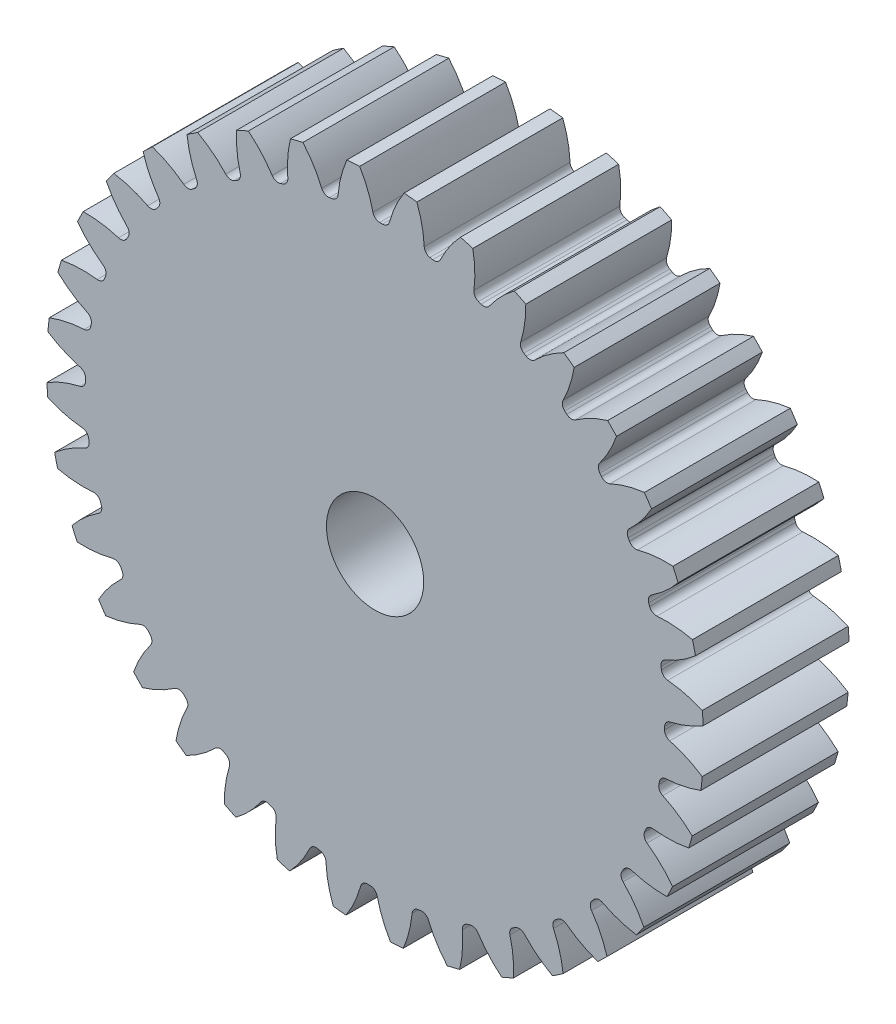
SolidWorks part; units mm, degrees
ref_plane "Front" through (0, 0, 0) normal (0, 0, 1) x (1, 0, 0)
ref_plane "Top" through (0, 0, 0) normal (0, 1, 0) x (1, 0, 0)
ref_plane "Right" through (0, 0, 0) normal (1, 0, 0) x (0, 0, -1)
sketch "Sketch3" plane through (0, 0, 0) normal (0, 0, 1) x (1, 0, 0)
  circle A0 centre (0, 0) radius 214.4889
  dimension "od" = 428.9778
extrude "gearBody" add sketch "Sketch3" along normal blind 95.25
sketch "Sketch2" plane through (0, 0, 0) normal (0, 0, 1) x (1, 0, 0)
  line L0 (0, 0) -> (176.4107, 73.0717) construction
  line L1 (213.8789, -19.1165) -> (0, 0) construction
  line L2 (0, 0) -> (36.3143, 0) construction
  line L3 (203.1478, 4.6072) -> (202.7804, -13.0525) construction
  line L5 (202.9641, -4.2227) -> (0, 0) construction
  line L7 (0, 0) -> (190.9455, 0) construction
  arc A0 (190.9428, 1.0226) -> (190.735, -8.9634) centre (0, 0) ccw construction
  arc A1 (214.2528, 10.0619) -> (213.6489, -18.9644) centre (0, 0) ccw construction
  arc A2 (203.1478, 4.6072) -> (202.7804, -13.0525) centre (0, 0) ccw construction
  arc A3 (189.0268, -4.8452) -> (189.0648, -3.021) centre (0, 0) ccw
  arc A4 (213.8789, -19.1165) -> (192.4196, -9.3979) centre (173.2188, -80.3457) ccw
  arc A5 (213.8789, -19.1165) -> (214.4889, 10.2043) centre (0, 0) ccw
  arc A6 (214.4889, 10.2043) -> (192.644, 1.3867) centre (176.4107, 73.0717) cw
  arc A7 (189.0648, -3.021) -> (192.644, 1.3867) centre (193.6587, -3.0944) cw
  arc A8 (192.4196, -9.3979) -> (189.0268, -4.8452) centre (193.6199, -4.9629) cw
  point P6 (214.4889, 10.2043)
  point P22 (213.8789, -19.1165)
  dimension "baseDia" = 381.8911
  dimension "od" = 428.9778
  dimension "pd" = 406.4
  dimension "rd" = 378.1778
  dimension "rFillet" = 4.5946
  dimension "pointX" = 214.4889
  dimension "pointY" = 10.2043
  dimension "CTT" = 17.6597
  dimension "flankCenterAngle" = 22.5
extrude "toothCut" cut sketch "Sketch2" along normal through all
pattern_circular "CirPattern1" count 36 over 360 about axis through (0, 0, 0) along (0, 0, 1) of "toothCut"
sketch "hub1Dia" plane through (0, 0, 0) normal (0, 0, -1) x (-1, 0, 0)
  circle A0 centre (0, 0) radius 12.7
  dimension "hub1Dia" = 25.4
sketch "hub2Dia" plane through (0, 0, 95.25) normal (0, 0, 1) x (1, 0, 0)
  circle A0 centre (0, 0) radius 12.7
  dimension "hub2dia" = 25.4
sketch "boreDia" plane through (0, 0, 0) normal (0, 0, 1) x (1, 0, 0)
  circle A0 centre (0, 0) radius 31.75
  dimension "boreDia" = 63.5
extrude "bore" cut sketch "boreDia" against normal mid plane 25400
